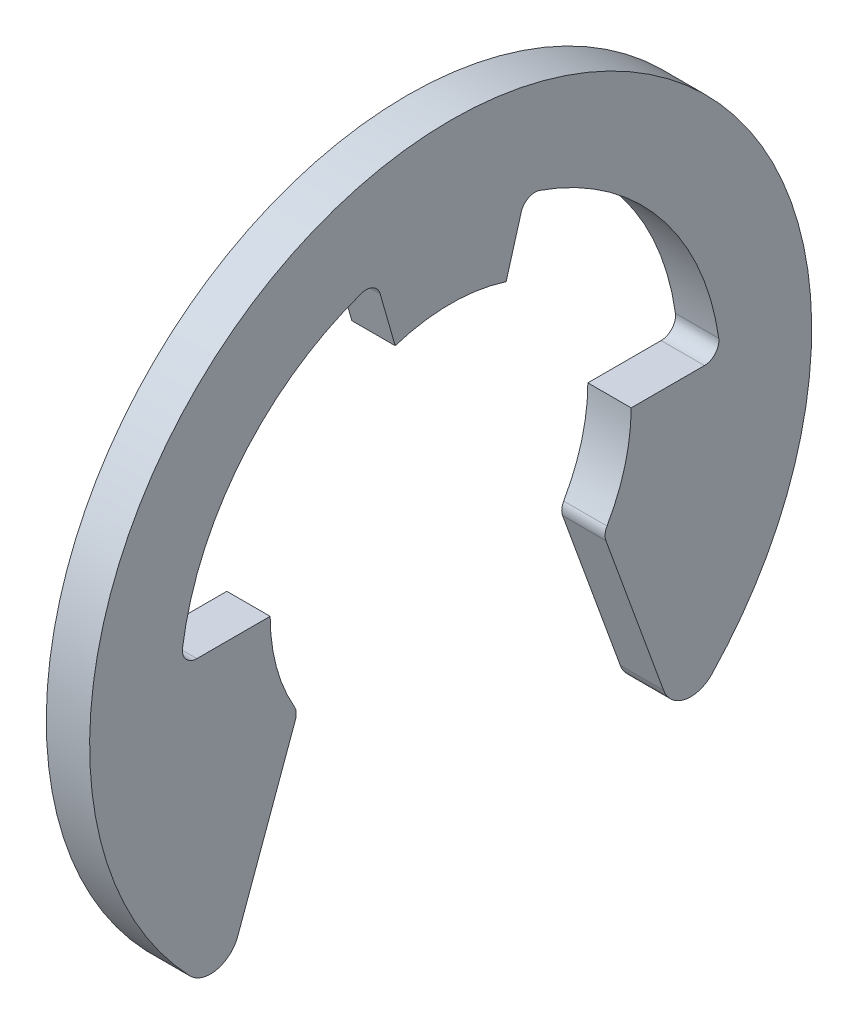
SolidWorks part; units mm, degrees
ref_plane "Plan1" through (0, 0, 0) normal (0, 0, 1) x (1, 0, 0)
ref_plane "Plan2" through (0, 0, 0) normal (0, 1, 0) x (1, 0, 0)
ref_plane "Plan3" through (0, 0, 0) normal (1, 0, 0) x (0, 0, -1)
sketch "Esquisse1" plane through (0, 0, 0) normal (1, 0, 0) x (0, 0, -1)
  line L0 (0, 0) -> (6.3102, -7.7577) construction
  line L1 (0, 0) -> (0, -9.1601) construction
  line L2 (-20, 0) -> (20, 0) construction
  line L3 (0, 0) -> (2.7564, 9.6126) construction
  line L4 (-20, 0.6) -> (20, 0.6) construction
  line L5 (1.5364, 5.3581) -> (6.3102, -7.7577) construction
  line L6 (1.5364, 5.3581) -> (1.9539, 6.8141)
  line L7 (-5, 0.6) -> (-7.0292, 0.6)
  line L8 (4.3007, -2.2367) -> (5.8996, -6.6297)
  line L9 (5, 0.6) -> (7.0292, 0.6)
  line L10 (-4.3007, -2.2367) -> (-5.8996, -6.6297)
  line L11 (-1.5364, 5.3581) -> (-1.9539, 6.8141)
  arc A0 (7.2297, -6.9088) -> (-7.2297, -6.9088) centre (0, 0) ccw
  arc A1 (7.4252, 1.0563) -> (2.4702, 7.0815) centre (0, 0) ccw
  arc A2 (1.5364, 5.3581) -> (-1.5364, 5.3581) centre (0, 0.6) ccw
  arc A3 (5, 0.6) -> (4.3302, -1.8999) centre (0, 0.6) cw
  arc A4 (7.2297, -6.9088) -> (5.8996, -6.6297) centre (6.6514, -6.3561) cw
  arc A5 (2.4702, 7.0815) -> (1.9539, 6.8141) centre (2.3384, 6.7039) ccw
  arc A6 (7.4252, 1.0563) -> (7.0292, 0.6) centre (7.0292, 1) cw
  arc A7 (-7.4252, 1.0563) -> (-7.0292, 0.6) centre (-7.0292, 1) ccw
  arc A8 (-2.4702, 7.0815) -> (-1.9539, 6.8141) centre (-2.3384, 6.7039) cw
  arc A9 (-7.2297, -6.9088) -> (-5.8996, -6.6297) centre (-6.6514, -6.3561) ccw
  arc A10 (-5, 0.6) -> (-4.3302, -1.8999) centre (0, 0.6) ccw
  arc A11 (-7.4252, 1.0563) -> (-2.4702, 7.0815) centre (0, 0) cw
  arc A12 (4.3007, -2.2367) -> (4.3302, -1.8999) centre (4.6766, -2.0999) cw
  arc A13 (-4.3007, -2.2367) -> (-4.3302, -1.8999) centre (-4.6766, -2.0999) ccw
  point P24 (2.0673, 7.2095)
  dimension "D1" = 10
  dimension "D2" = 0.6
  dimension "D3" = 7.5
  dimension "D4" = 0.8
  dimension "D7" = 0.4
  dimension "D8" = 16
  dimension "r" = 0.4
  dimension "D9" = 20
extrude "Base-Extrusion" add sketch "Esquisse1" along normal blind 1.2
equation "\"D3@Esquisse1\" = (\"D1@Esquisse1\"+\"dn@Esquisse1\")/2"
equation "\"D4@Esquisse1\"=\"r@Esquisse1\"*2"
equation "\"r@Esquisse1\"=\"D1@Base-Extrusion\"/3"
equation "\"D2@Esquisse1\"=\"D1@Base-Extrusion\"/2"
